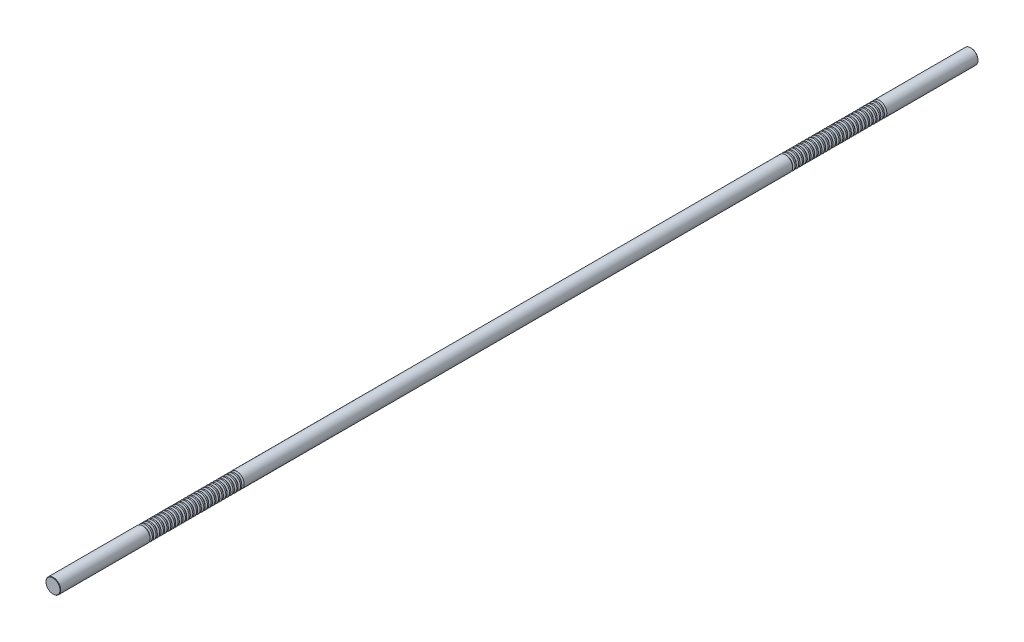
SolidWorks part; units mm, degrees
ref_plane "Front Plane" through (0, 0, 0) normal (0, 0, 1) x (1, 0, 0)
ref_plane "Top Plane" through (0, 0, 0) normal (0, 1, 0) x (1, 0, 0)
ref_plane "Right Plane" through (0, 0, 0) normal (1, 0, 0) x (0, 0, -1)
sketch "Sketch1" plane through (0, 0, 0) normal (0, 0, 1) x (1, 0, 0)
  circle A0 centre (0, 0) radius 8
  dimension "D1" = 16
extrude "Boss-Extrude1" add sketch "Sketch1" along normal mid plane 1000
chamfer "Chamfer1" distance 0.4 angle 45 2 edges at (8, 0, -500) (8, 0, 500)
sketch "Sketch2" plane through (0, 0, 0) normal (1, 0, 0) x (0, 0, -1)
  line L0 (400.3014, 8) -> (397.6986, 8)
  line L1 (499.6, 8) -> (-499.6, 8) construction
  line L2 (397.6986, 8) -> (398.3014, 5.75)
  line L3 (398.3014, 5.75) -> (399.6986, 5.75)
  line L4 (399.6986, 5.75) -> (400.3014, 8)
  line L5 (500, -7.6) -> (500, 7.6) construction
  point P4 (399, 8)
  point P7 (399, 5.75)
  point P8 (400, 6.875)
  point P9 (398, 6.875)
  dimension "D1" = 2
  dimension "D2" = 100
  dimension "D3" = 2.25
  dimension "D4" = 30
revolve "Cut-Revolve1" cut sketch "Sketch2" angle 360 about axis through (0, 0, 500) along (0, 0, -1)
pattern_linear "LPattern1" count 26 spacing 4 along (0, 0, 1) of "Cut-Revolve1"
pattern_linear "LPattern2" count 2 spacing 700 along (0, 0, 1) of "Cut-Revolve1", "LPattern1"
